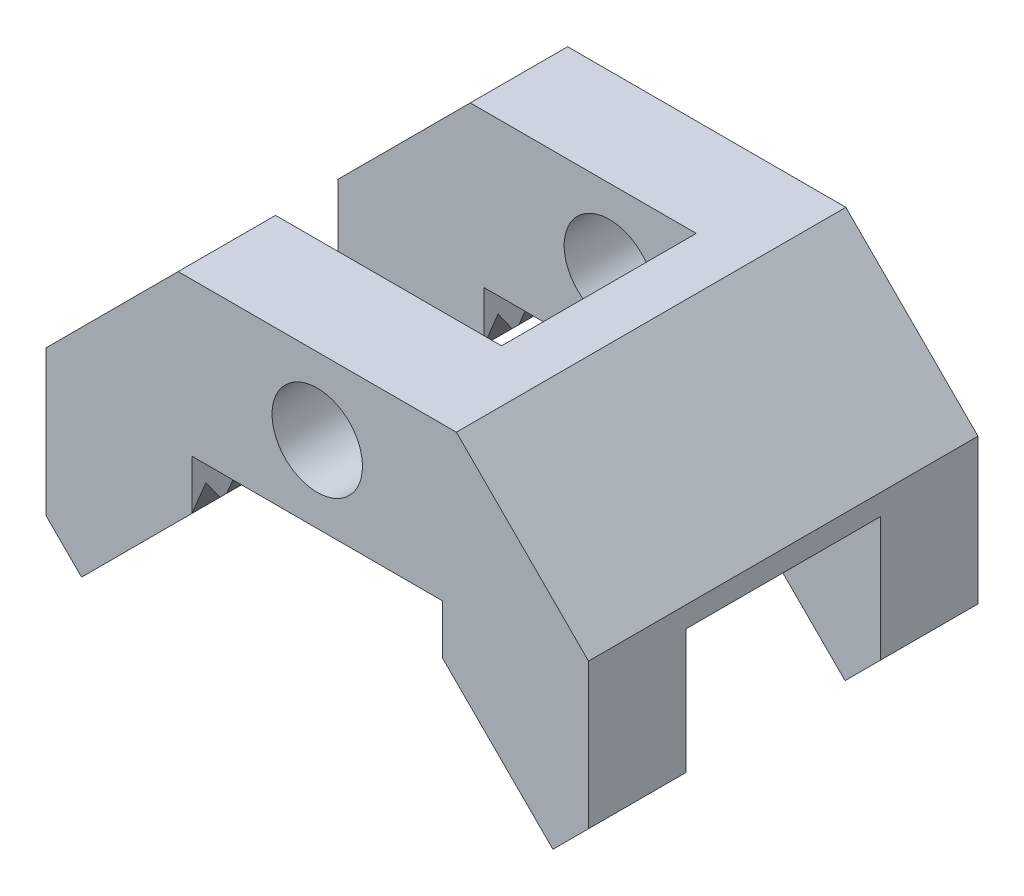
SolidWorks part; units mm, degrees
ref_plane "前视基准面" through (0, 0, 0) normal (0, 0, 1) x (1, 0, 0)
ref_plane "上视基准面" through (0, 0, 0) normal (0, 1, 0) x (1, 0, 0)
ref_plane "右视基准面" through (0, 0, 0) normal (1, 0, 0) x (0, 0, -1)
other "Configuration Table"
sketch "草图1" plane through (0, 0, 0) normal (0, 0, 1) x (1, 0, 0)
  line L0 (20, 11) -> (-20, 11)
  line L1 (-20, 11) -> (-39, -8)
  line L2 (-39, -8) -> (-39, -28.8823)
  line L3 (-39, -28.8823) -> (-33.8848, -33.9975)
  line L5 (-18, -11) -> (18, -11)
  line L6 (0, 11) -> (0, -11) construction
  line L7 (-33.8848, -33.9975) -> (-18, -18.1127)
  line L8 (-18, -18.1127) -> (-18, -11)
  line L9 (0, 0) -> (-4.5962, 4.5962) construction
  line L10 (0, 0) -> (4.5962, 4.5962) construction
  line L11 (18, -18.1127) -> (18, -11)
  line L12 (33.8848, -33.9975) -> (18, -18.1127)
  line L13 (39, -28.8823) -> (33.8848, -33.9975)
  line L14 (39, -8) -> (39, -28.8823)
  line L15 (20, 11) -> (39, -8)
  circle A0 centre (0, 0) radius 6.5
  dimension "D1" = 13
  dimension "D2" = 11
  dimension "D3" = 11
  dimension "D4" = 135
  dimension "D5" = 18
  dimension "D6" = 22
  dimension "D7" = 20
  dimension "D8" = 39
  dimension "D9" = 48
extrude "凸台-拉伸1" add sketch "草图1" along normal mid plane 56
sketch "草图2" plane through (0, 0, 0) normal (0, 0, 1) x (1, 0, 0)
  line L0 (12.5, 11) -> (12.5, -11)
  line L1 (20, 11) -> (-20, 11) construction
  line L2 (-18, -11) -> (18, -11) construction
  line L3 (12.5, -11) -> (39, -11)
  line L4 (39, -28.8823) -> (39, -8) construction
  line L5 (20, 11) -> (12.5, 11)
  line L6 (39, -11) -> (39, -8)
  line L7 (39, -8) -> (20, 11)
  dimension "D1" = 12.5
extrude "切除-拉伸1" cut sketch "草图2" against normal mid plane 28 flip side to cut
sketch "草图3"
sketch_block_instance "块2-1"
sketch_block "块2" parameters "D1"=5, "D2"=90, "D3"=45
extrude "切除-拉伸2" cut sketch "草图3" against normal blind 28
sketch "草图15" plane through (-33.9411, -33.9411, 0) normal (-0.7071, -0.7071, 0) x (0, 0, 1)
  line L0 (28, 7.1543) -> (28, -0.0797) construction
  line L1 (28, -0.0797) -> (14, -0.0797) construction
  line B0 (-28, -0.0797) -> (-26, 1.9203)
  line B1 (-24, -0.0797) -> (-26, 1.9203)
  line B2 (-23, -0.0797) -> (-21, 1.9203)
  line B3 (-19, -0.0797) -> (-21, 1.9203)
  line B4 (-18, -0.0797) -> (-16, 1.9203)
  line B5 (-14, -0.0797) -> (-16, 1.9203)
  line B6 (-28, -0.0797) -> (-24, -0.0797)
  line B7 (14, -0.0797) -> (16, 1.9203)
  line B8 (18, -0.0797) -> (16, 1.9203)
  line B9 (19, -0.0797) -> (21, 1.9203)
  line B10 (23, -0.0797) -> (21, 1.9203)
  line B11 (24, -0.0797) -> (26, 1.9203)
  line B12 (28, -0.0797) -> (26, 1.9203)
  line B13 (-23, -0.0797) -> (-19, -0.0797)
  line B14 (-18, -0.0797) -> (-14, -0.0797)
  line B15 (14, -0.0797) -> (18, -0.0797)
  line B16 (19, -0.0797) -> (23, -0.0797)
  line B17 (24, -0.0797) -> (28, -0.0797)
sketch_block_instance "块2-2"
extrude "切除-拉伸3" cut sketch "草图15" against normal blind 28
